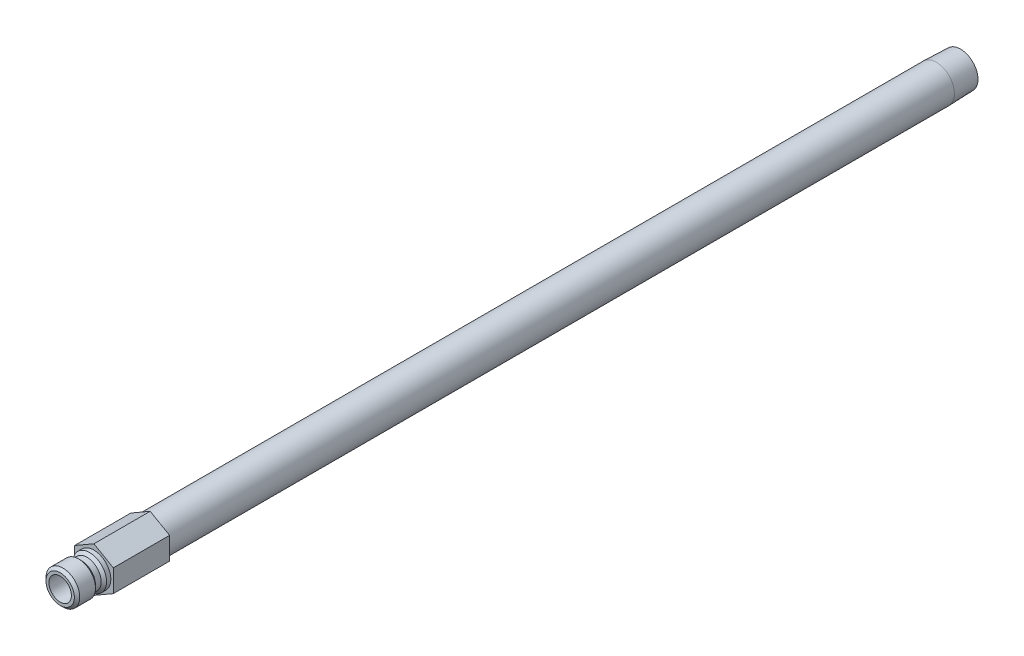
SolidWorks part; units mm, degrees
ref_plane "Front Plane" through (0, 0, 0) normal (0, 0, 1) x (1, 0, 0)
ref_plane "Top Plane" through (0, 0, 0) normal (0, 1, 0) x (1, 0, 0)
ref_plane "Right Plane" through (0, 0, 0) normal (1, 0, 0) x (0, 0, -1)
sketch "Sketch1" plane through (0, 0, 0) normal (1, 0, 0) x (0, 0, -1)
  line L0 (0, 0) -> (-12.7, 0) construction
  line L1 (-9.525, 3.175) -> (-9.525, 4.0005)
  line L2 (-3.556, 4.0005) -> (-3.556, 0) construction
  line L3 (-8.763, 4.7625) -> (-4.318, 4.7625)
  line L4 (0, 5.1435) -> (0, 3.4163) construction
  line L5 (-3.556, 4.0005) -> (-1.9685, 4.0005)
  line L6 (-1.2065, 4.7625) -> (0, 4.7625)
  line L7 (0, 4.7625) -> (0, 5.1435)
  line L8 (-3.556, 4.0005) -> (-4.318, 4.7625)
  line L9 (-1.9685, 4.0005) -> (-1.2065, 4.7625)
  line L10 (-9.525, 4.0005) -> (-8.763, 4.7625)
  line L12 (0, 5.1435) -> (237.617, 5.1435)
  line L13 (237.617, 5.1435) -> (244.475, 4.9292)
  line L14 (244.475, 4.9292) -> (244.475, 2.3813)
  line L15 (0, 0) -> (15.875, 0) construction
  line L16 (15.875, 0) -> (15.875, 4.7625) construction
  line L17 (15.875, 4.7625) -> (0, 4.7625) construction
  line L18 (0.127, 2.3813) -> (244.475, 2.3813)
  line L19 (0.127, 3.175) -> (-9.525, 3.175)
  line L20 (0, 3.175) -> (0, 0) construction
  line L21 (0.127, 2.3813) -> (0.127, 3.175)
  dimension "D1" = 9.525
  dimension "D2" = 1.5875
  dimension "D3" = 0.762
  dimension "D4" = 45
  dimension "D5" = 5.969
  dimension "D6" = 45
  dimension "D7" = 1.79
  dimension "D8" = 6.858
  dimension "D9" = 254
  dimension "D10" = 3.175
  dimension "D11" = 25.4
  dimension "D12" = 4.7625
  dimension "D13" = 6.35
  dimension "D14" = 9.525
  dimension "D15" = 10.287
  dimension "D16" = 9.652
revolve "Revolve1" add sketch "Sketch1" angle 360 about L0
sketch "Sketch2" plane through (0, 0, 0) normal (0, 0, 1) x (1, 0, 0)
  line L1 (-5.461, 3.1529) -> (-5.461, -3.1529)
  line L2 (-5.461, -3.1529) -> (0, -6.3058)
  line L3 (0, -6.3058) -> (5.461, -3.1529)
  line L4 (5.461, -3.1529) -> (5.461, 3.1529)
  line L5 (5.461, 3.1529) -> (0, 6.3058)
  line L6 (0, 6.3058) -> (-5.461, 3.1529)
  circle A0 centre (0, 0) radius 5.461 construction
  circle A1 centre (0, 0) radius 2.3812 construction
  circle A2 centre (0, 0) radius 2.3812
  dimension "D1" = 10.922
extrude "Boss-Extrude1" add sketch "Sketch2" against normal up to vertex (15.875 mm away) from vertex at 0
